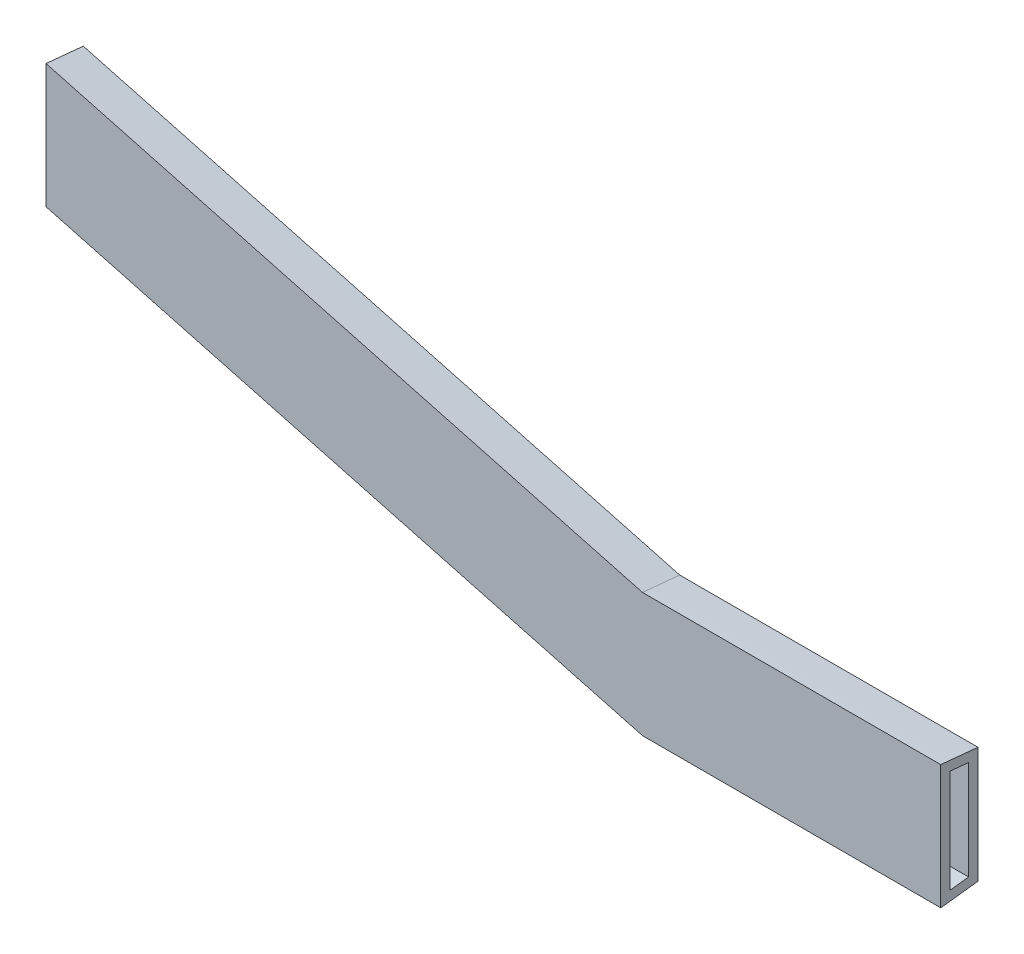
SolidWorks part; units mm, degrees
ref_plane "Front Plane" through (0, 0, 0) normal (0, 0, 1) x (1, 0, 0)
ref_plane "Top Plane" through (0, 0, 0) normal (0, 1, 0) x (1, 0, 0)
ref_plane "Right Plane" through (0, 0, 0) normal (1, 0, 0) x (0, 0, -1)
curve "Curve1"
sketch "Sketch1" plane through (0, 0, 0) normal (1, 0, 0) x (0, 0, -1)
  line L0 (64.2938, 17.9381) -> (64.2938, 7.3735)
  line L1 (0, 0) -> (0, 95.7684) construction
  line L4 (67.4688, 17.6298) -> (67.4688, 7.7502)
  line L5 (65.0938, 17.0589) -> (65.0938, 8.2772)
  line L6 (66.6687, 16.9056) -> (66.6687, 8.4636)
  spline S0 degree 1 poles (65.0938, 8.2772) (66.6687, 8.4636) knots 0 0 1 1 construction
  spline S1 degree 1 poles (66.6687, 16.9056) (65.0938, 17.0589) knots 0 0 1 1 construction
  spline S2 degree 3 poles (65.0938, 8.2772) (65.6186, 8.3406) (66.1436, 8.4027) (66.6687, 8.4636) knots 0.731305 0.731305 0.731305 0.731305 0.736464 0.736464 0.736464 0.736464
  spline S3 degree 3 poles (66.6687, 16.9056) (66.1438, 16.9577) (65.6189, 17.0088) (65.0938, 17.0589) knots 1.268574 1.268574 1.268574 1.268574 1.273764 1.273764 1.273764 1.273764
  spline S5 degree 3 poles (64.2938, 7.3735) (65.3515, 7.504) (66.4098, 7.6297) (67.4688, 7.7502) knots 0.728362 0.728362 0.728362 0.728362 0.738787 0.738787 0.738787 0.738787
  spline S6 degree 3 poles (67.4688, 17.6298) (66.4108, 17.7363) (65.3525, 17.8393) (64.2938, 17.9381) knots 1.266201 1.266201 1.266201 1.266201 1.276646 1.276646 1.276646 1.276646
  dimension "D1" = 0.8001
extrude "Boss-Extrude1" add sketch "Sketch1" along normal blind 25.4
ref_plane "Plane1" through (76.2, 0, 0) normal (1, 0, 0) x (0, 0, -1)
sketch "Sketch2" plane through (0, 0, -64.2937) normal (0, 0, 1) x (1, 0, 0)
  line L0 (25.4, 7.3735) -> (76.2, 7.3735) construction
  line L1 (76.2, -1.7462) -> (76.2, 1.7463) construction
  line L2 (25.4, 7.3735) -> (76.2, 20.9853)
  dimension "D1" = 15
sketch "Sketch3" plane through (25.4, 0, 0) normal (1, 0, 0) x (0, 0, -1)
  line L2 (65.0938, 17.0589) -> (65.0938, 8.2772)
  line L3 (66.6687, 8.4636) -> (66.6687, 16.9056)
  line L4 (65.0938, 17.0589) -> (65.0938, 8.2772)
  line L5 (66.6687, 8.4636) -> (66.6687, 16.9056)
  line L6 (64.2938, 17.9381) -> (64.2938, 7.3735)
  line L7 (67.4688, 7.7502) -> (67.4688, 17.6298)
  line L8 (64.2938, 17.9381) -> (64.2938, 7.3735)
  line L9 (67.4688, 7.7502) -> (67.4688, 17.6298)
  arc A2 (66.6687, 8.4636) -> (65.0938, 8.2772) centre (105.3869, -325.35) ccw
  arc A3 (66.6687, 16.9056) -> (65.0938, 17.0589) centre (23.3236, -420.3542) ccw
  arc A4 (66.6687, 8.4636) -> (65.0938, 8.2772) centre (105.3869, -325.35) ccw
  arc A5 (66.6687, 16.9056) -> (65.0938, 17.0589) centre (23.3236, -420.3542) ccw
  spline S2 degree 3 poles (119.6461, 2956.7409) (-900.6484, -3170.3465) (726.6922, 3146.0713) (392.6353, -2925.1901) knots -1.938074 -1.938074 -1.938074 -1.938074 2.956328 2.956328 2.956328 2.956328 only from (64.2938, 7.3735) to (67.4688, 7.7502)
  spline S3 degree 3 poles (686.639, 2925.5717) (127.9611, -2970.4064) (45.8681, 3002.9346) (-554.569, -2894.7055) knots -0.417714 -0.417714 -0.417714 -0.417714 2.85636 2.85636 2.85636 2.85636 only from (67.4688, 17.6298) to (64.2938, 17.9381)
  spline S4 degree 3 poles (64.2938, 7.3735) (65.3515, 7.504) (66.4098, 7.6297) (67.4688, 7.7502) knots 0.728362 0.728362 0.728362 0.728362 0.738787 0.738787 0.738787 0.738787
  spline S5 degree 3 poles (67.4688, 17.6298) (66.4108, 17.7363) (65.3525, 17.8393) (64.2938, 17.9381) knots 1.266201 1.266201 1.266201 1.266201 1.276646 1.276646 1.276646 1.276646
  dimension "D1" = 0
  dimension "D2" = 0
sweep "Sweep1" add profiles "Sketch3" path "Sketch2"
mirror "Mirror1" about plane through (0, 0, 0) normal (1, 0, 0) of "Sweep1", "Boss-Extrude1"
sketch "Sketch4" plane through (0, 0, 0) normal (1, 0, 0) x (0, 0, -1)
  line L1 (56.0613, 38.0439) -> (78.7578, 38.0439)
  line L2 (56.0613, 38.0439) -> (56.0613, 1.9832)
  line L3 (56.0613, 1.9832) -> (78.7578, 1.9832)
  line L4 (78.7578, 38.0439) -> (78.7578, 1.9832)
extrude "Cut-Extrude1" cut sketch "Sketch4" along normal through all
